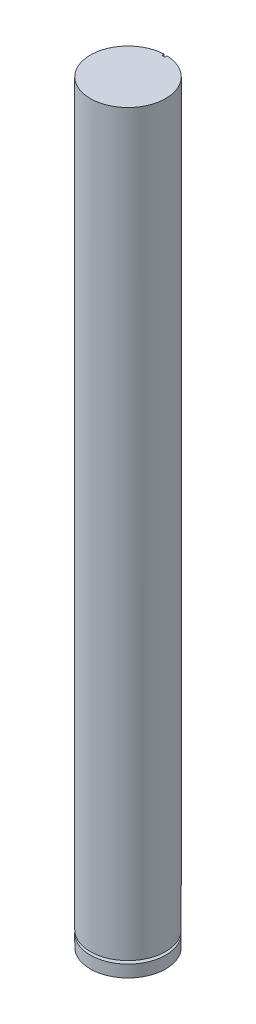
SolidWorks part; units mm, degrees
ref_plane "Front Plane" through (0, 0, 0) normal (0, 0, 1) x (1, 0, 0)
ref_plane "Top Plane" through (0, 0, 0) normal (0, 1, 0) x (1, 0, 0)
ref_plane "Right Plane" through (0, 0, 0) normal (1, 0, 0) x (0, 0, -1)
sketch "Sketch1" plane through (0, 0, 0) normal (0, 1, 0) x (1, 0, 0)
  circle A0 centre (0, 0) radius 2.5
  dimension "D1" = 5
extrude "Boss-Extrude1" add sketch "Sketch1" along normal blind 50
sketch "Sketch2" plane through (0, 0, 0) normal (1, 0, 0) x (0, 0, -1)
  line L0 (2.5, 0) -> (2.5, 50) construction
  line L1 (2.5, 1) -> (2, 1)
  line L2 (2.5, 1) -> (2.5, 0.8)
  line L3 (2.5, 0.8) -> (2, 0.8)
  line L4 (2, 1) -> (2, 0.8)
  line L5 (0, 0) -> (0, 4.1838) construction
  dimension "D1" = 0.5
  dimension "D2" = 0.2
  dimension "D3" = 0.8
revolve "Cut-Revolve1" cut sketch "Sketch2" angle 360 about L5
sketch "Sketch3" plane through (0, 50, 0) normal (0, 1, 0) x (1, 0, 0)
  line L0 (0, 0) -> (0, 5.0523) construction
  line L2 (-0.1, 2.5) -> (0.1, 2.5)
  line L3 (-0.1, 2.5) -> (-0.1, 2.35)
  line L4 (-0.1, 2.35) -> (0.1, 2.35)
  line L5 (0.1, 2.5) -> (0.1, 2.35)
  dimension "D1" = 0.2
  dimension "D2" = 0.15
extrude "Cut-Extrude1" cut sketch "Sketch3" against normal blind 3
